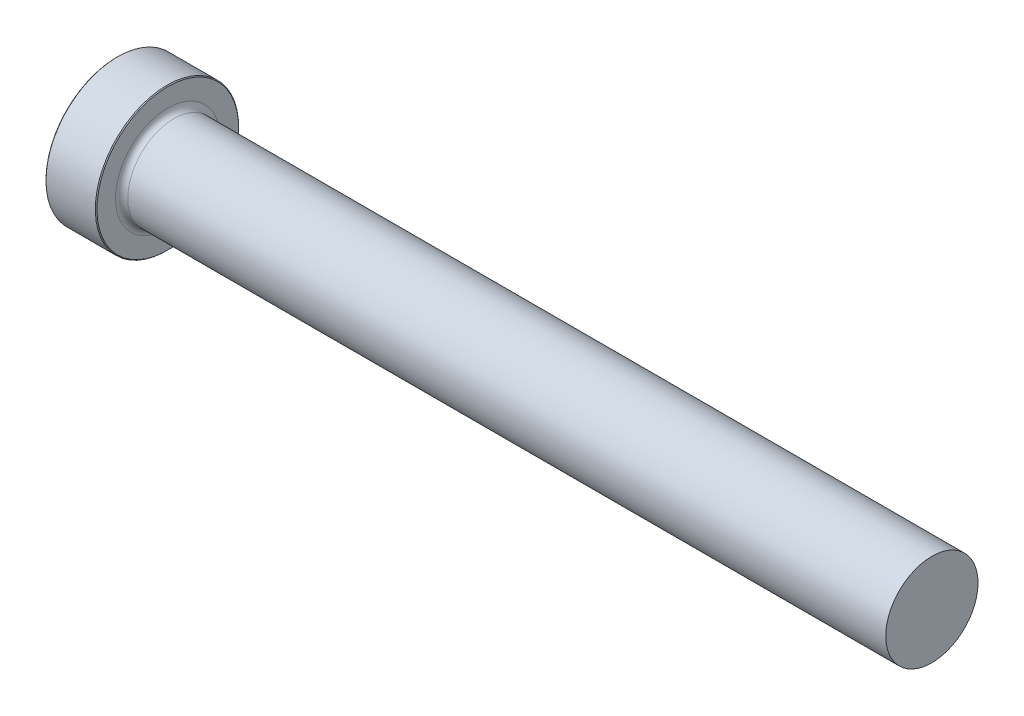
SolidWorks part; units mm, degrees
ref_plane "Front Plane" through (0, 0, 0) normal (0, 0, 1) x (1, 0, 0)
ref_plane "Top Plane" through (0, 0, 0) normal (0, 1, 0) x (1, 0, 0)
ref_plane "Right Plane" through (0, 0, 0) normal (1, 0, 0) x (0, 0, -1)
sketch "Sketch1" plane through (0, 0, 0) normal (0, 0, 1) x (1, 0, 0)
  line L0 (0, 0) -> (0, 8.9297)
  line L1 (0, 8.9297) -> (6.35, 8.9297)
  line L2 (6.35, 8.9297) -> (6.35, 6.5129)
  line L3 (7.112, 5.7509) -> (101.6, 5.7509)
  line L4 (101.6, 5.7509) -> (101.6, 0)
  line L5 (101.6, 0) -> (0, 0)
  line L6 (101.6, 0) -> (101.6, -5.7509) construction
  line L7 (101.6, -5.7509) -> (6.35, -5.7509) construction
  line L8 (0, 0) -> (0, -8.9297) construction
  line L9 (0, -8.9297) -> (6.35, -8.9297) construction
  line L10 (6.35, -8.9297) -> (6.35, -5.7509) construction
  arc A0 (6.35, 6.5129) -> (7.112, 5.7509) centre (7.112, 6.5129) ccw
  dimension "D4" = 0.762
  dimension "L" = 101.6
  dimension "D" = 11.5018
  dimension "H" = 17.8594
  dimension "T" = 6.35
revolve "Revolve1" add sketch "Sketch1" angle 360 about L5
chamfer "Chamfer1" distance 0.1016 angle 45 2 edges at (0, 8.9297, 0) (6.35, 8.9297, 0)
